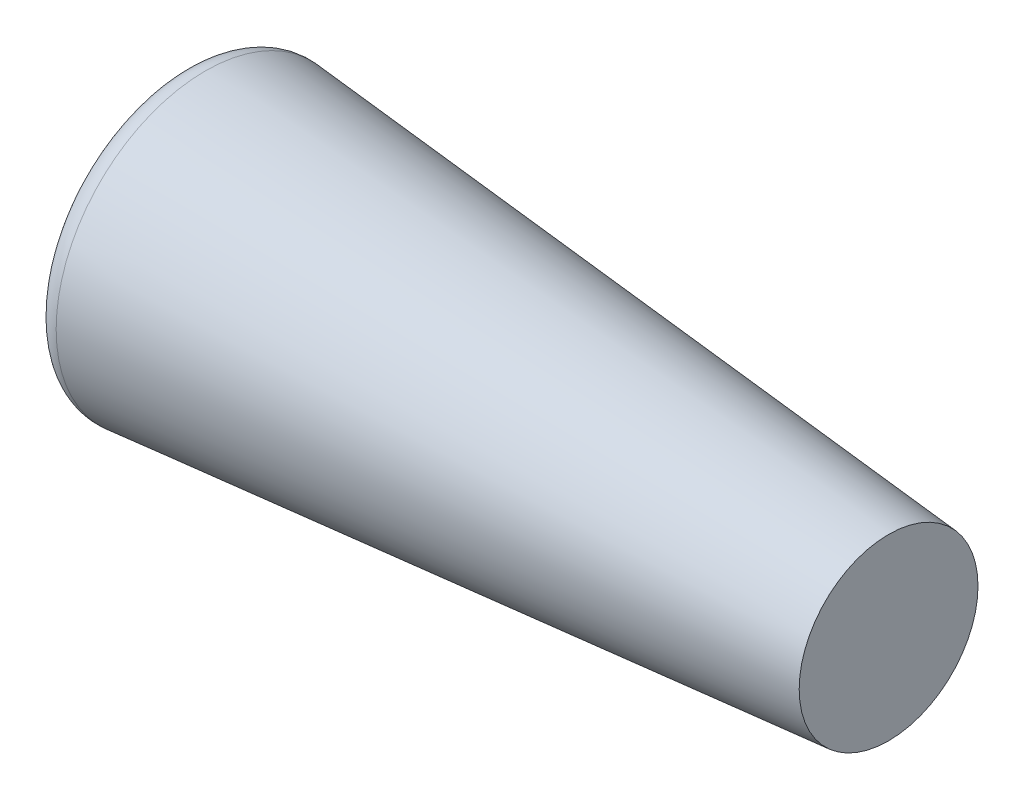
SolidWorks part; units mm, degrees
ref_plane "Front" through (0, 0, 0) normal (0, 0, 1) x (1, 0, 0)
ref_plane "Top" through (0, 0, 0) normal (0, 1, 0) x (1, 0, 0)
ref_plane "Right" through (0, 0, 0) normal (1, 0, 0) x (0, 0, -1)
sketch "Sketch1" plane through (0, 0, 0) normal (0, 0, 1) x (1, 0, 0)
  line L0 (0, 0) -> (7, 0)
  line L1 (7, 0) -> (7, 0.8876)
  line L2 (7, 0.8876) -> (0, 1.5)
  line L3 (0, 1.5) -> (0, 0)
revolve "Revolve1" add sketch "Sketch1" angle 360 about L0
fillet "Fillet2" radius 0.2 1 edges at (0, 0, 1.5)
